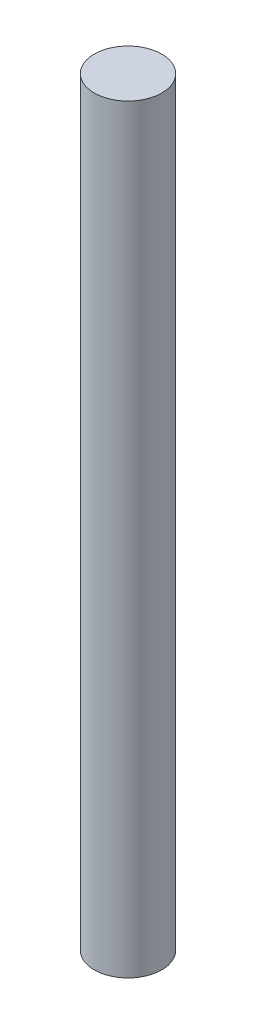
SolidWorks part; units mm, degrees
ref_plane "Front" through (0, 0, 0) normal (0, 0, 1) x (1, 0, 0)
ref_plane "Top" through (0, 0, 0) normal (0, 1, 0) x (1, 0, 0)
ref_plane "Right" through (0, 0, 0) normal (1, 0, 0) x (0, 0, -1)
sketch "Sketch1" plane through (0, 0, 0) normal (0, 0, 1) x (1, 0, 0)
  line L0 (0, 0) -> (0, 45)
revolve "Revolve-Thin1" add sketch "Sketch1" angle 360 about L0
